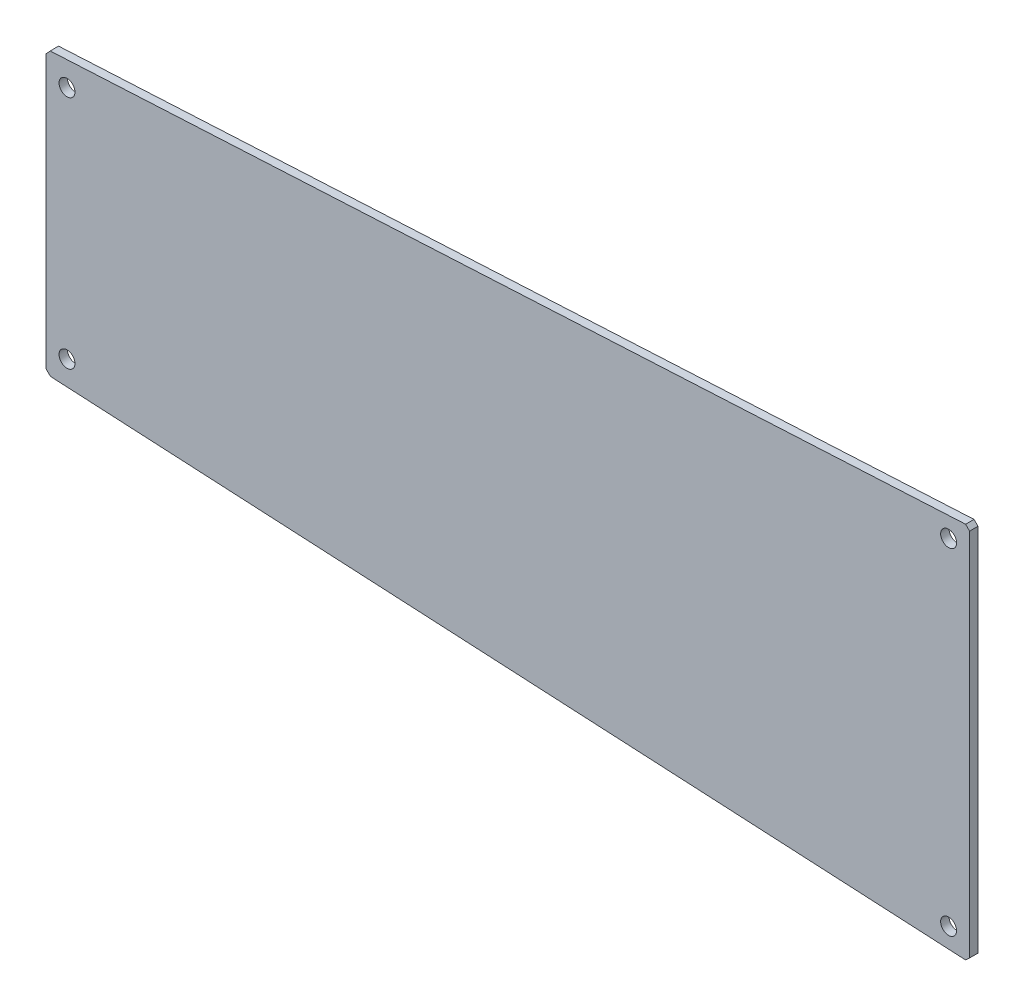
SolidWorks part; units mm, degrees
ref_plane "Plan de face" through (0, 0, 0) normal (0, 0, 1) x (1, 0, 0)
ref_plane "Plan de dessus" through (0, 0, 0) normal (0, 1, 0) x (1, 0, 0)
ref_plane "Plan de droite" through (0, 0, 0) normal (1, 0, 0) x (0, 0, -1)
sketch "Esquisse1" plane through (0, 0, 0) normal (0, 0, 1) x (1, 0, 0)
  line L0 (-316.2957, 0) -> (148.2904, 0) construction
  line L1 (32.8928, 0) -> (32.8928, 45)
  line L2 (32.8928, 45) -> (-187.1072, 33.5)
  line L3 (-187.1072, 33.5) -> (-187.1072, 0)
  line L4 (32.8928, 0) -> (-187.1072, 0)
  circle A0 centre (-182.1072, 28) radius 1.9
  circle A1 centre (27.8928, 40) radius 1.9
  dimension "D4" = 5
  dimension "D1" = 45
  dimension "D2" = 220
  dimension "D3" = 33.5
  dimension "D5" = 5.5
  dimension "D6" = 5
  dimension "D7" = 5
extrude "Extrusion1" add sketch "Esquisse1" along normal blind 2
mirror "Symétrie1" about plane through (32.8928, 0, 2) normal (0, 1, 0)
chamfer "Chanfrein1" distance 1 angle 45 1 edges at (-187.1072, 33.5, 1)
chamfer "Chanfrein2" distance 1 angle 45 1 edges at (-187.1072, -33.5, 1)
chamfer "Chanfrein4" distance 1 angle 45 1 edges at (32.8928, -45, 1)
chamfer "Chanfrein5" distance 1 angle 45 1 edges at (32.8928, 45, 1)
